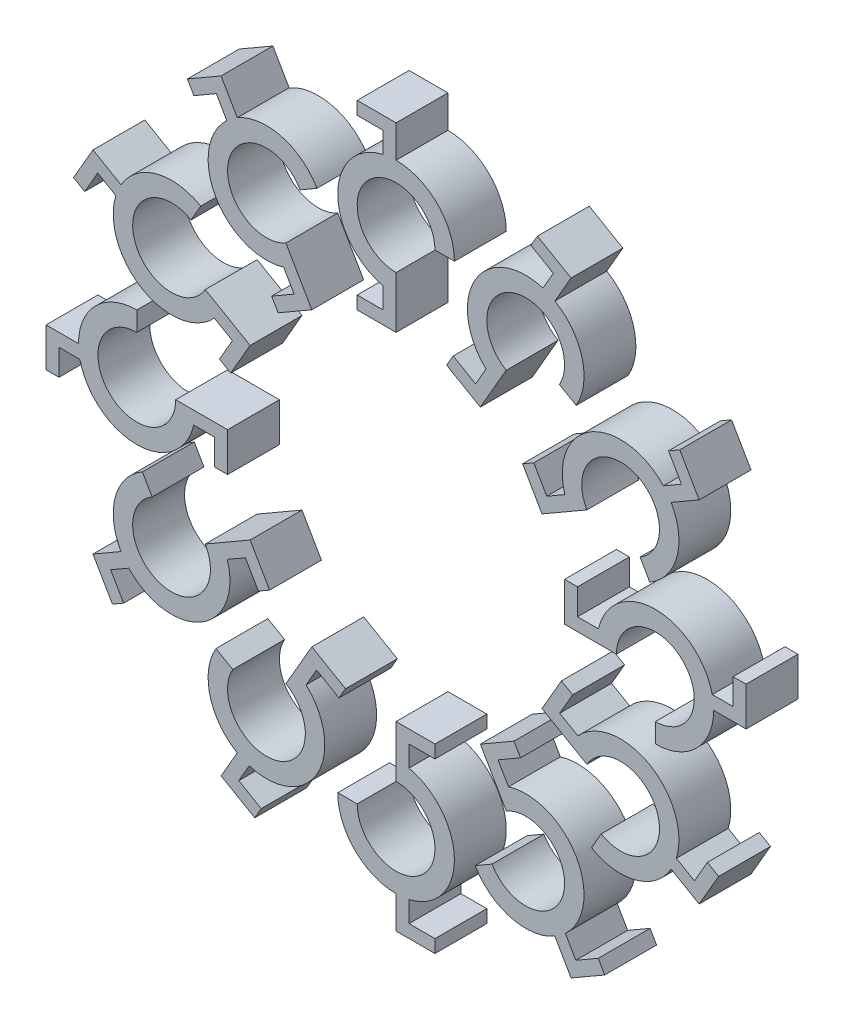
SolidWorks part; units mm, degrees
ref_plane "前视基准面" through (0, 0, 0) normal (0, 0, 1) x (1, 0, 0)
ref_plane "上视基准面" through (0, 0, 0) normal (0, 1, 0) x (1, 0, 0)
ref_plane "右视基准面" through (0, 0, 0) normal (1, 0, 0) x (0, 0, -1)
sketch "草图1" plane through (0, 0, 0) normal (0, 0, 1) x (1, 0, 0)
  circle A0 centre (0, 0) radius 3
  circle A1 centre (0, 0) radius 4.5
  dimension "D1" = 1.5
extrude "凸台-拉伸1" add sketch "草图1" along normal blind 4
sketch "草图2" plane through (0, 0, 4) normal (0, 0, 1) x (1, 0, 0)
  line L1 (0, 0) -> (4.5, 0)
  line L2 (0, 0) -> (0, 4.5)
  line L3 (0, 4.5) -> (4.5, 4.5)
  line L4 (4.5, 0) -> (4.5, 4.5)
extrude "切除-拉伸1" cut sketch "草图2" against normal through all
sketch "草图3" plane through (0, 0, 4) normal (0, 0, 1) x (1, 0, 0)
  line L1 (3, 0) -> (7, 0)
  line L2 (3, 0) -> (3, -1)
  line L3 (3, -1) -> (7, -1)
  line L4 (7, 0) -> (7, -1)
  line L5 (7, -1) -> (6, -1)
  line L6 (7, -1) -> (7, -3)
  line L7 (7, -3) -> (6, -3)
  line L8 (6, -1) -> (6, -3)
extrude "凸台-拉伸3" add sketch "草图3" against normal through all contours L4 L1 L3 M2 | L3 L8 L7 L6
sketch "草图4" plane through (0, 0, 4) normal (0, 0, 1) x (1, 0, 0)
  line L0 (0, 0) -> (-4.5, 0) construction
  line L2 (-3, 0) -> (-7, 0)
  line L3 (-3, 0) -> (-3, -1)
  line L4 (-3, -1) -> (-7, -1)
  line L5 (-7, 0) -> (-7, -1)
  line L6 (-7, -1) -> (-6, -1)
  line L7 (-7, -1) -> (-7, -3)
  line L8 (-7, -3) -> (-6, -3)
  line L9 (-6, -1) -> (-6, -3)
  arc A0 (0, 4.5) -> (4.3875, -1) centre (0, 0) ccw construction
  arc A1 (0, 3) -> (3, 0) centre (0, 0) ccw construction
extrude "凸台-拉伸4" add sketch "草图4" against normal through all contours L2 L5 L4 M2 | L9 L4 L7 L8
sketch "草图5" plane through (0, 0, 4) normal (0, 0, 1) x (1, 0, 0)
  circle A0 centre (20, 0) radius 20
pattern_curve "曲线阵列1" parameters "D1"=12, "D3"=10, "D2"=1, "D4"=10
